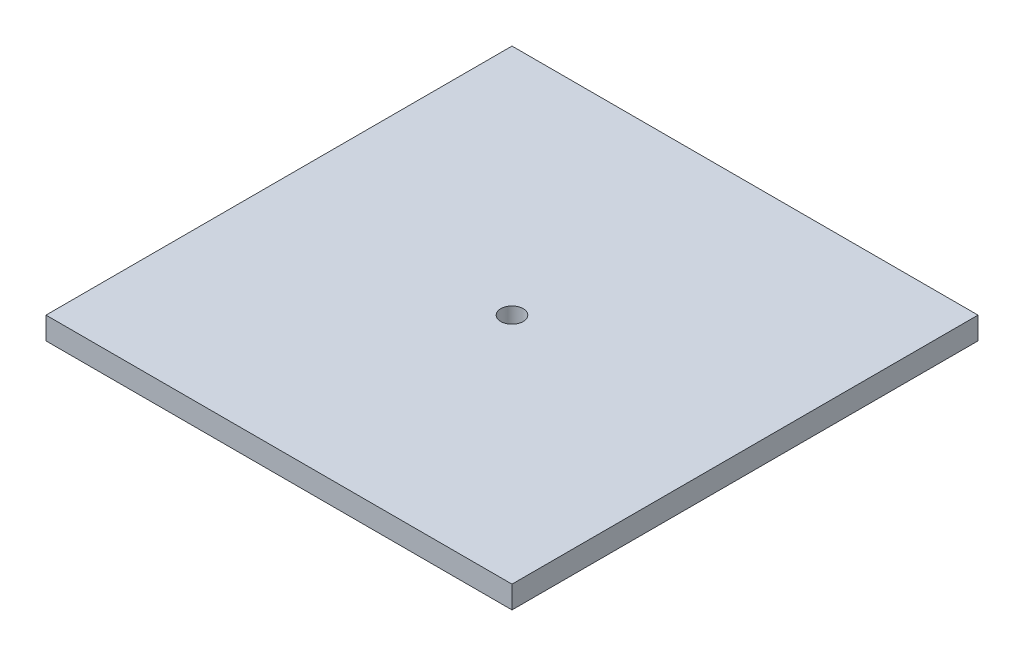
SolidWorks part; units mm, degrees
ref_plane "Plan de face" through (0, 0, 0) normal (0, 0, 1) x (1, 0, 0)
ref_plane "Plan de dessus" through (0, 0, 0) normal (0, 1, 0) x (1, 0, 0)
ref_plane "Plan de droite" through (0, 0, 0) normal (1, 0, 0) x (0, 0, -1)
sketch "Esquisse1" plane through (0, 0, 0) normal (0, 1, 0) x (1, 0, 0)
  line L0 (21.8949, 62.5) -> (69.8476, 62.5) construction
  line L1 (0, 0) -> (125, 0)
  line L2 (0, 0) -> (0, 125)
  line L3 (0, 125) -> (125, 125)
  line L4 (125, 0) -> (125, 125)
  line L5 (62.5, 20.1934) -> (62.5, 70.3116) construction
  circle A0 centre (62.5, 62.5) radius 3
extrude "Extrusion1" add sketch "Esquisse1" along normal blind 6
